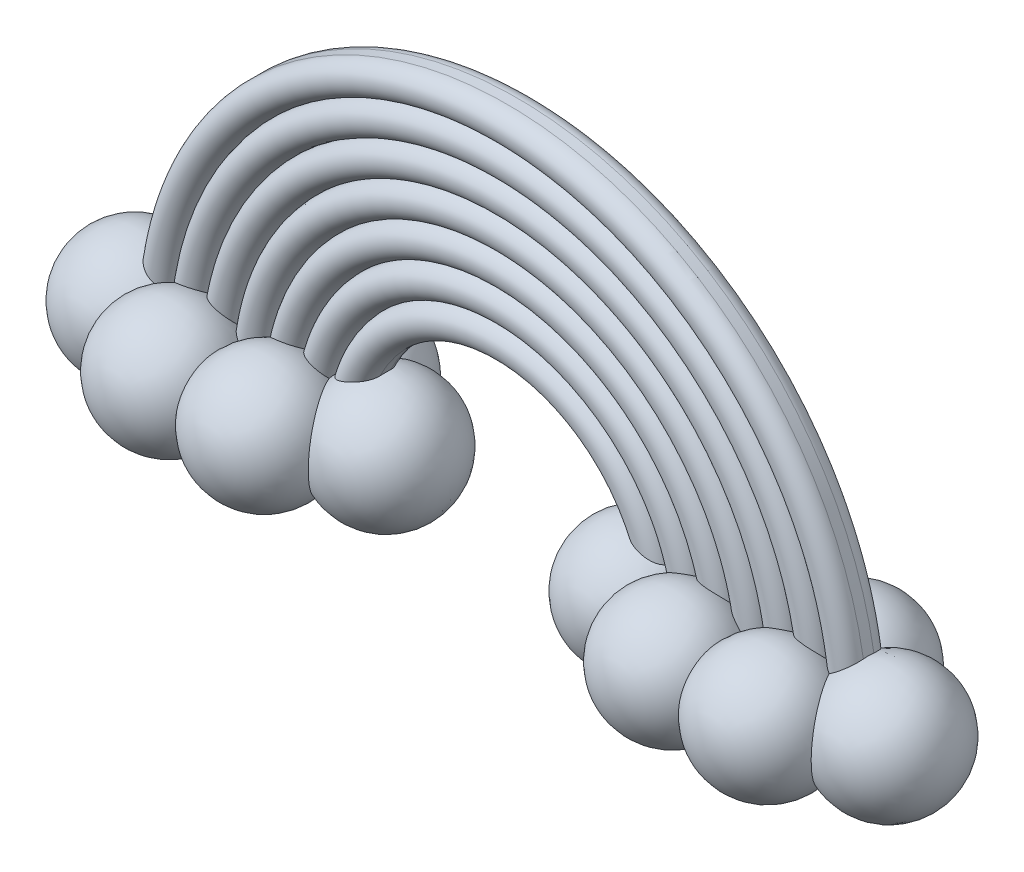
SolidWorks part; units mm, degrees
ref_plane "正面" through (0, 0, 0) normal (0, 0, 1) x (1, 0, 0)
ref_plane "平面" through (0, 0, 0) normal (0, 1, 0) x (1, 0, 0)
ref_plane "右側面" through (0, 0, 0) normal (1, 0, 0) x (0, 0, -1)
sketch "ｽｹｯﾁ1" plane through (0, 0, 0) normal (0, 0, 1) x (1, 0, 0)
  arc A0 (75, 0) -> (-75, 0) centre (0, 0) ccw
  dimension "D1" = 75
sketch "ｽｹｯﾁ2" plane through (0, 0, 0) normal (0, 1, 0) x (1, 0, 0)
  line L0 (165, 2.5) -> (165, -2.5) construction
  line L1 (172.5, 2.5) -> (172.5, -2.5)
  line L2 (157.5, -2.5) -> (157.5, 2.5)
  arc A0 (172.5, 2.5) -> (157.5, 2.5) centre (165, 2.5) ccw
  arc A1 (157.5, -2.5) -> (172.5, -2.5) centre (165, -2.5) ccw
  dimension "D1" = 20
  dimension "D2" = 15
sweep "ｽｲｰﾌﾟ1" add profiles "ｽｹｯﾁ2" path "ｽｹｯﾁ1"
pattern_linear "直線ﾊﾟﾀｰﾝ1" count 7 spacing 15 of "ｽｲｰﾌﾟ1"
sketch "ｽｹｯﾁ3" plane through (0, 0, 0) normal (0, 1, 0) x (1, 0, 0)
  line L0 (67.5, 0) -> (172.5, 0) construction
  line L1 (67.5, 2.5) -> (67.5, -2.5) construction
  line L2 (172.5, -2.5) -> (172.5, 2.5) construction
  ellipse E0 centre (120, 0) end of major axis (180, 0) minor radius 22.5
  dimension "D1" = 120
  dimension "D2" = 45
sketch "ｽｹｯﾁ4" plane through (0, 0, 0) normal (0, 1, 0) x (1, 0, 0)
  line L0 (180, 43.2897) -> (180, -43.0967) construction
  line L1 (180, 30) -> (180, -30)
  arc A0 (180, -30) -> (180, 30) centre (180, 0) ccw
  dimension "D1" = 60
revolve "回転1" add sketch "ｽｹｯﾁ4" angle 360 about L0
pattern_curve "ｶｰﾌﾞ ﾊﾟﾀｰﾝ1" of "回転1" parameters "D1"=6, "D3"=10, "D2"=1, "D4"=10
mirror "ﾐﾗｰ1" about plane through (0, 0, 0) normal (1, 0, 0) of "ｶｰﾌﾞ ﾊﾟﾀｰﾝ1", "回転1"
